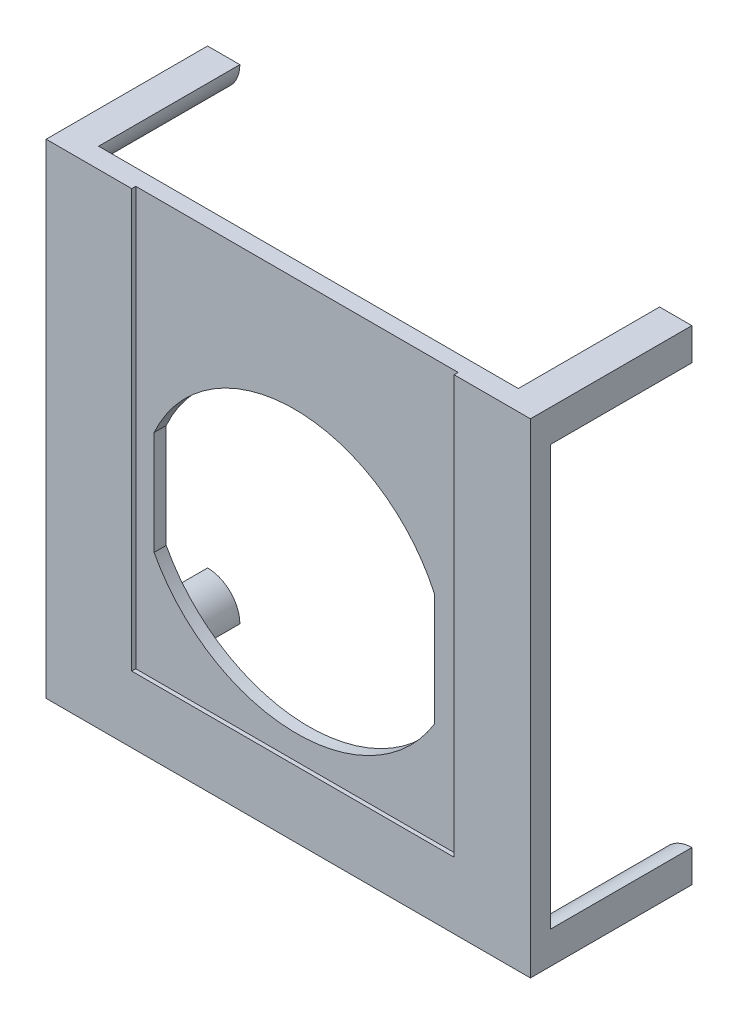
SolidWorks part; units mm, degrees
ref_plane "Front Plane" through (0, 0, 0) normal (0, 0, 1) x (1, 0, 0)
ref_plane "Top Plane" through (0, 0, 0) normal (0, 1, 0) x (1, 0, 0)
ref_plane "Right Plane" through (0, 0, 0) normal (1, 0, 0) x (0, 0, -1)
sketch "草图1" plane through (0, 0, 0) normal (0, 0, 1) x (1, 0, 0)
  line L1 (30, -30) -> (-30, -30)
  line L2 (30, -30) -> (30, 30)
  line L3 (30, 30) -> (-30, 30)
  line L4 (-30, -30) -> (-30, 30)
  line L5 (30, -30) -> (-30, 30) construction
  line L6 (30, 30) -> (-30, -30) construction
  point P0 (0, 0)
  dimension "D1" = 60
  dimension "D2" = 60
extrude "凸台-拉伸1" add sketch "草图1" along normal blind 2.5
sketch "草图2" plane through (0, 0, 2.5) normal (0, 0, 1) x (1, 0, 0)
  line L2 (-17.1275, 4.7171) -> (-17.1275, -8.15)
  line L3 (17.6329, 4.7171) -> (17.6329, -9.1534)
  arc A2 (17.6329, 4.7171) -> (-17.1275, 4.7171) centre (0.2527, -3.1523) ccw
  arc A3 (-17.1275, -8.15) -> (17.6329, -9.1534) centre (0.5386, 1.2541) ccw
extrude "切除-拉伸1" cut sketch "草图2" against normal blind 3
sketch "草图3" plane through (0, 0, 2.5) normal (0, 0, 1) x (1, 0, 0)
  line L5 (-19.3959, 30) -> (-19.3959, -21.7693)
  line L6 (30, 30) -> (-30, 30) construction
  line L7 (-19.3959, -21.7693) -> (20.5417, -21.7693)
  line L8 (20.5417, -21.7693) -> (20.5417, 30)
  line L9 (20.5417, 30) -> (-19.3959, 30)
extrude "切除-拉伸2" cut sketch "草图3" against normal blind 0.5
sketch "草图4" plane through (0, 0, 0) normal (0, 0, -1) x (-1, 0, 0)
  line L2 (-22.7929, -0.7732) -> (-22.7929, -8.7569)
  line L3 (22.289, -0.7732) -> (22.289, -8.3726)
  line L4 (-17.6329, -9.1534) -> (-17.6329, 4.7171) construction
  arc A2 (-22.7929, -0.7732) -> (22.289, -0.7732) centre (-0.2519, -0.7732) cw
  arc A3 (-22.7929, -8.7569) -> (22.289, -8.3726) centre (-0.3115, -1.5754) ccw
  dimension "D1" = 5.16
extrude "切除-拉伸3" cut sketch "草图4" against normal blind 0.5
sketch "草图5" plane through (0, 0, 0) normal (0, 0, -1) x (-1, 0, 0)
  line L0 (-30, 30) -> (30, 30) construction
  line L1 (-30, -30) -> (-30, 30) construction
  line L2 (30, 30) -> (30, -30) construction
  line L3 (30, -30) -> (-30, -30) construction
  line L4 (-30, 26) -> (-30, 30)
  line L5 (-30, 30) -> (-26, 30)
  line L6 (26, 30) -> (30, 30)
  line L7 (30, 30) -> (30, 26)
  line L8 (30, -26) -> (30, -30)
  line L9 (30, -30) -> (26, -30)
  line L10 (-26, -30) -> (-30, -30)
  line L11 (-30, -30) -> (-30, -26)
  arc A0 (-26, 30) -> (-30, 26) centre (-30, 30) cw
  arc A1 (26, 30) -> (30, 26) centre (30, 30) ccw
  arc A2 (-30, -26) -> (-26, -30) centre (-30, -30) cw
  arc A3 (26, -30) -> (30, -26) centre (30, -30) cw
extrude "凸台-拉伸2" add sketch "草图5" along normal blind 17.5
